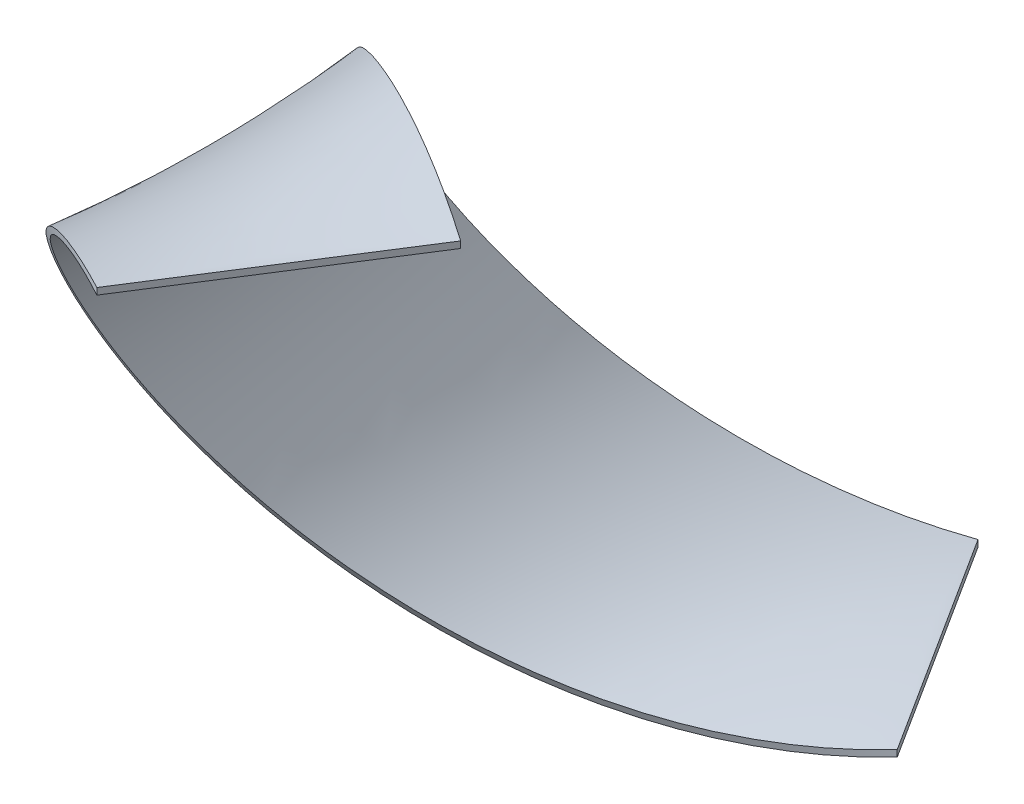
SolidWorks part; units mm, degrees
ref_plane "Vorne" through (0, 0, 0) normal (0, 0, 1) x (1, 0, 0)
ref_plane "Oben" through (0, 0, 0) normal (0, 1, 0) x (1, 0, 0)
ref_plane "Rechts" through (0, 0, 0) normal (1, 0, 0) x (0, 0, -1)
sketch "Skizze1" plane through (0, 0, 0) normal (0, 0, 1) x (1, 0, 0)
  circle A0 centre (0, 0) radius 25
  dimension "D1" = 50
curve "Spirale/Helix1"
sketch "Skizze2" plane through (0, 0, 0) normal (1, 0, 0) x (0, 0, -1)
  line L0 (0, 0) -> (0, -25) construction
  spline S0 degree 3 poles (0, -25) (-1.3861, -25) (-4.168, -24.4256) (-8.333, -21.8994) (-12.5001, -17.8808) (-16.6666, -12.6436) (-20.8333, -6.5448) (-25, 0) (-29.1667, 6.5448) (-33.3334, 12.6436) (-37.4999, 17.8808) (-41.667, 21.8994) (-45.832, 24.4256) (-48.6139, 25) (-50, 25) knots 0 0 0 0 0.083333 0.166667 0.25 0.333333 0.416667 0.5 0.583333 0.666667 0.75 0.833333 0.916667 1 1 1 1 construction
ref_plane "Ebene1" through (0, 0, 0) normal (0.8436, 0, -0.537) x (-0.537, 0, -0.8436)
sketch "Skizze3" plane through (0, 0, 0) normal (0.8436, 0, -0.537) x (-0.537, 0, -0.8436)
  line L1 (10, -24.75) -> (-10, -24.75)
  line L2 (10, -24.75) -> (10, -25.25)
  line L3 (10, -25.25) -> (-10, -25.25)
  line L4 (-10, -24.75) -> (-10, -25.25)
  line L5 (10, -24.75) -> (-10, -25.25) construction
  line L6 (10, -25.25) -> (-10, -24.75) construction
  point P0 (0, -25)
  dimension "D1" = 20
  dimension "D2" = 0.5
sweep "Austragung1" add profiles "Skizze3" path "Spirale/Helix1"
